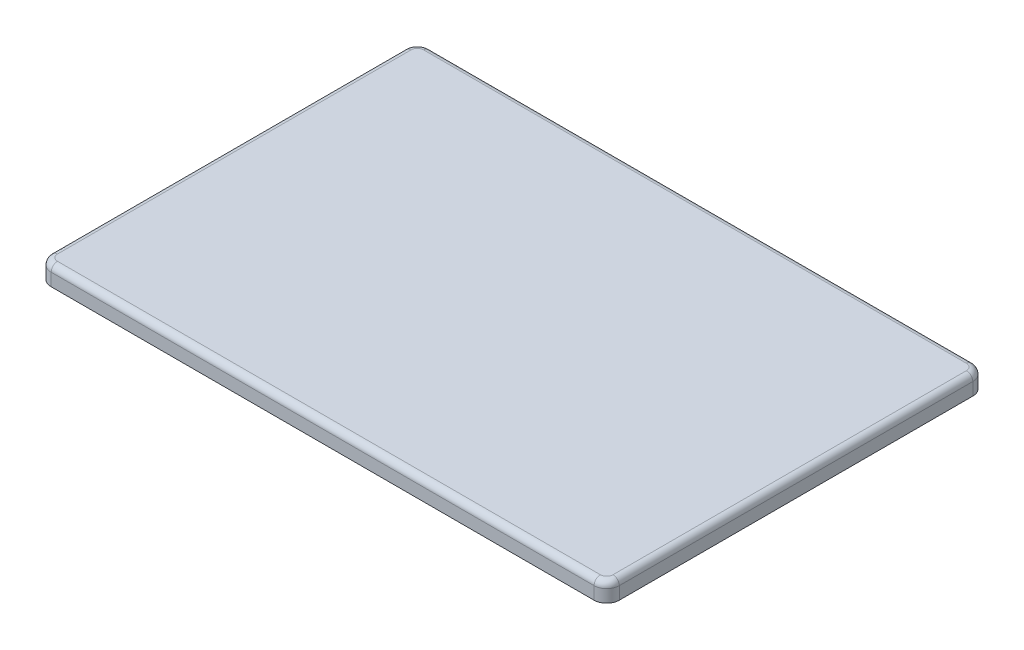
SolidWorks part; units mm, degrees
ref_plane "正面" through (0, 0, 0) normal (0, 0, 1) x (1, 0, 0)
ref_plane "平面" through (0, 0, 0) normal (0, 1, 0) x (1, 0, 0)
ref_plane "右側面" through (0, 0, 0) normal (1, 0, 0) x (0, 0, -1)
sketch "ｽｹｯﾁ1" plane through (0, 0, 0) normal (0, 1, 0) x (0, 0, -1)
  line L1 (-28, 45) -> (28, 45)
  line L2 (-30, 43) -> (-30, -43)
  line L3 (-28, -45) -> (28, -45)
  line L4 (30, 43) -> (30, -43)
  arc A0 (30, 43) -> (28, 45) centre (28, 43) ccw
  arc A1 (28, -45) -> (30, -43) centre (28, -43) ccw
  arc A2 (-30, -43) -> (-28, -45) centre (-28, -43) ccw
  arc A3 (-28, 45) -> (-30, 43) centre (-28, 43) ccw
  point P7 (30, 45)
  point P10 (30, -45)
  point P15 (-30, 45)
  dimension "D5" = 2
  dimension "D1" = 30
  dimension "D2" = 60
  dimension "D3" = 45
  dimension "D4" = 90
extrude "押し出し1" add sketch "ｽｹｯﾁ1" along normal mid plane 3
fillet "ﾌｨﾚｯﾄ1" radius 1 8 edges at (-44.4142, 1.5, 29.4142) (-45, 1.5, 0) (-44.4142, 1.5, -29.4142) (0, 1.5, -30) (44.4142, 1.5, -29.4142) (45, 1.5, 0) (44.4142, 1.5, 29.4142) (0, 1.5, 30)
sketch "ｽｹｯﾁ2" plane through (0, -1.5, 0) normal (0, -1, 0) x (1, 0, 0)
  line L1 (-43, 28.2) -> (43, 28.2)
  line L2 (-43.2, 28) -> (-43.2, -28)
  line L3 (-43, -28.2) -> (43, -28.2)
  line L4 (43.2, 28) -> (43.2, -28)
  arc A0 (-43, 28.2) -> (-43.2, 28) centre (-43, 28) ccw
  arc A1 (43.2, 28) -> (43, 28.2) centre (43, 28) ccw
  arc A2 (43, -28.2) -> (43.2, -28) centre (43, -28) ccw
  arc A3 (-43.2, -28) -> (-43, -28.2) centre (-43, -28) ccw
  point P7 (-43.2, 28.2)
  point P10 (43.2, 28.2)
  point P13 (43.2, -28.2)
  dimension "D5" = 0.2
  dimension "D1" = 43.2
  dimension "D2" = 86.4
  dimension "D3" = 28.2
  dimension "D4" = 56.4
extrude "押し出し2" cut sketch "ｽｹｯﾁ2" against normal blind 1
sketch "ｽｹｯﾁ4" plane through (0, -0.5, 0) normal (0, -1, 0) x (1, 0, 0)
  line L0 (-45, -28) -> (-45, 28) construction
  line L1 (-32.45, 17.45) -> (-27.55, 17.45)
  line L2 (-32.45, 17.45) -> (-32.45, 14.25)
  line L3 (-32.45, 14.25) -> (-27.55, 14.25)
  line L4 (-27.55, 17.45) -> (-27.55, 14.25)
  line L5 (45, 28) -> (45, -28) construction
  line L6 (27.55, 14.25) -> (32.45, 14.25)
  line L7 (27.55, 14.25) -> (27.55, 17.45)
  line L8 (27.55, 17.45) -> (32.45, 17.45)
  line L9 (32.45, 14.25) -> (32.45, 17.45)
  line L10 (-32.45, 17.45) -> (-27.55, 14.25) construction
  line L11 (-32.45, 14.25) -> (-27.55, 17.45) construction
  line L12 (27.55, 17.45) -> (32.45, 14.25) construction
  line L13 (27.55, 14.25) -> (32.45, 17.45) construction
  line L14 (-32.45, -14.25) -> (-27.55, -17.45) construction
  line L15 (-32.45, -14.25) -> (-27.55, -14.25)
  line L16 (-32.45, -14.25) -> (-32.45, -17.45)
  line L17 (-32.45, -17.45) -> (-27.55, -17.45)
  line L18 (-27.55, -14.25) -> (-27.55, -17.45)
  line L19 (27.55, -14.25) -> (32.45, -14.25)
  line L20 (27.55, -14.25) -> (27.55, -17.45)
  line L21 (27.55, -17.45) -> (32.45, -17.45)
  line L22 (32.45, -14.25) -> (32.45, -17.45)
  line L23 (-32.45, -17.45) -> (-27.55, -14.25) construction
  line L24 (27.55, -14.25) -> (32.45, -17.45) construction
  line L25 (27.55, -17.45) -> (32.45, -14.25) construction
  line L26 (-2.45, 17.45) -> (2.45, 14.25) construction
  line L27 (-2.45, 17.45) -> (2.45, 17.45)
  line L28 (-2.45, 17.45) -> (-2.45, 14.25)
  line L29 (-2.45, 14.25) -> (2.45, 14.25)
  line L30 (2.45, 17.45) -> (2.45, 14.25)
  line L31 (-2.45, -14.25) -> (2.45, -14.25)
  line L32 (-2.45, -14.25) -> (-2.45, -17.45)
  line L33 (-2.45, -17.45) -> (2.45, -17.45)
  line L34 (2.45, -14.25) -> (2.45, -17.45)
  line L35 (2.45, 17.45) -> (-2.45, 14.25) construction
  line L36 (-2.45, -14.25) -> (2.45, -17.45) construction
  line L37 (2.45, -14.25) -> (-2.45, -17.45) construction
  point P21 (30, 15.85)
  point P22 (30, -15.85)
  point P31 (-30, 15.85)
  point P32 (0, 15.85)
  point P33 (30, 15.85)
  dimension "D1" = 4.9
  dimension "D2" = 3.2
  dimension "D3" = 12.55
  dimension "D4" = 17.45
  dimension "D5" = 4.9
  dimension "D6" = 17.45
  dimension "D7" = 3.2
  dimension "D8" = 12.55
  dimension "D9" = 3.2
  dimension "D10" = 17.45
  dimension "D11" = 4.9
  dimension "D12" = 2.45
extrude "押し出し4" add sketch "ｽｹｯﾁ4" along normal blind 8 draft 0.6
fillet "ﾌｨﾚｯﾄ2" radius 0.8 24 edges at (-30, -8.5, 17.3662) (-27.6338, -8.5, 15.85) (-30, -8.5, 14.3338) (-32.3662, -8.5, 15.85) (30, -8.5, 17.3662) (32.3662, -8.5, 15.85) (30, -8.5, 14.3338) (27.6338, -8.5, 15.85) (30, -8.5, -14.3338) (32.3662, -8.5, -15.85) (30, -8.5, -17.3662) (27.6338, -8.5, -15.85) (-30, -8.5, -14.3338) (-27.6338, -8.5, -15.85) (-30, -8.5, -17.3662) (-32.3662, -8.5, -15.85) (0, -8.5, -14.3338) (2.3662, -8.5, -15.85) (0, -8.5, -17.3662) (-2.3662, -8.5, -15.85) (0, -8.5, 17.3662) (2.3662, -8.5, 15.85) (0, -8.5, 14.3338) (-2.3662, -8.5, 15.85)
